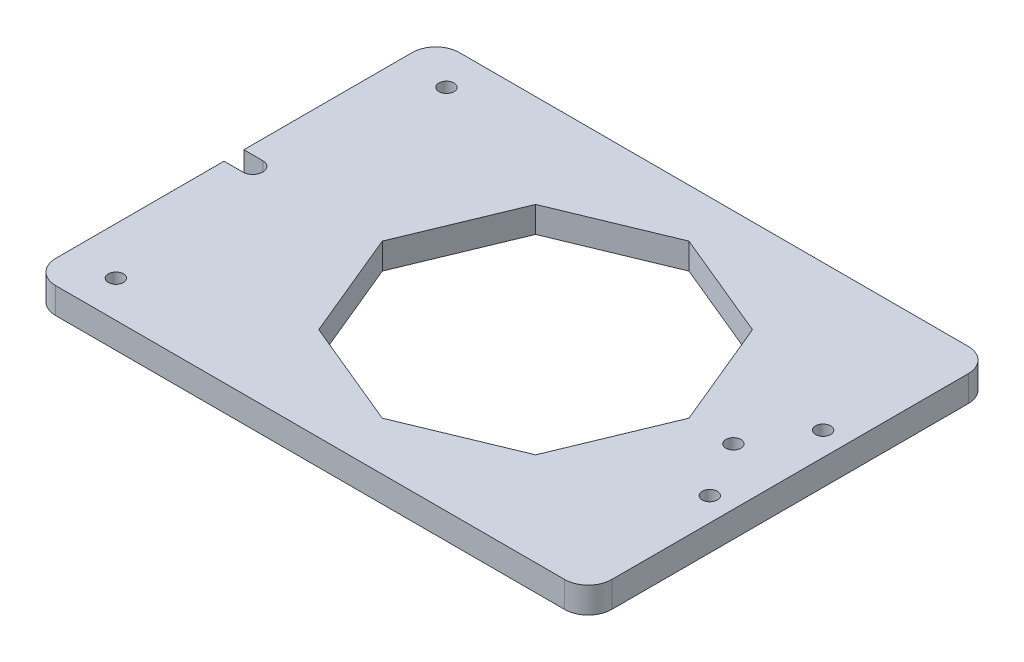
SolidWorks part; units mm, degrees
ref_plane "Front Plane" through (0, 0, 0) normal (0, 0, 1) x (1, 0, 0)
ref_plane "Top Plane" through (0, 0, 0) normal (0, 1, 0) x (1, 0, 0)
ref_plane "Right Plane" through (0, 0, 0) normal (1, 0, 0) x (0, 0, -1)
sketch "Sketch1" plane through (0, 0, 0) normal (0, 1, 0) x (1, 0, 0)
  line L9 (0, 42.74) -> (53.88, 42.74)
  line L15 (53.88, -42.74) -> (-63.88, -42.74)
  line L16 (-63.88, -42.74) -> (-63.88, -2.1)
  line L17 (-63.88, 42.74) -> (0, 42.74)
  line L19 (53.88, 42.74) -> (53.88, -42.74)
  line L31 (0, -32.4718) -> (22.961, -22.961)
  line L38 (-59.88, 2.1) -> (-63.88, 2.1)
  line L39 (-63.88, 2.1) -> (-63.88, 42.74)
  line L40 (-59.88, -2.1) -> (-63.88, -2.1)
  line L41 (27.7164, 11.4805) -> (25.4328, 16.9936)
  line L42 (25.4328, 16.9936) -> (22.961, 22.961)
  line L43 (27.7164, -11.4805) -> (22.961, -22.961)
  line L44 (27.7164, -11.4805) -> (32.4718, 0)
  line L47 (-11.4805, -27.7164) -> (0, -32.4718)
  line L48 (27.7164, 11.4805) -> (32.4718, 0)
  line L49 (-27.7164, -11.4805) -> (-22.961, -22.961)
  line L51 (-27.7164, 11.4805) -> (-32.4718, 0)
  line L53 (-11.4805, 27.7164) -> (-22.961, 22.961)
  line L55 (11.4805, 27.7164) -> (0, 32.4718)
  line L56 (11.4805, 27.7164) -> (22.961, 22.961)
  line L57 (-11.4805, 27.7164) -> (0, 32.4718)
  line L58 (-27.7164, 11.4805) -> (-22.961, 22.961)
  line L59 (-27.7164, -11.4805) -> (-32.4718, 0)
  line L60 (-11.4805, -27.7164) -> (-22.961, -22.961)
  line L68 (11.4805, -27.7164) -> (16.9936, -25.4328)
  line L70 (27.7164, -11.4805) -> (30, -5.9674)
  circle A3 centre (48.88, 12) radius 1.6
  circle A4 centre (48.88, -12) radius 1.6
  circle A6 centre (41.88, 0) radius 1.6
  circle A14 centre (-53.88, 35) radius 1.6
  circle A15 centre (-53.88, -35) radius 1.6
  arc A16 (-59.88, -2.1) -> (-59.88, 2.1) centre (-59.88, 0) ccw
  point P31 (0, 0)
  point P56 (0, 0)
  dimension "D1" = 8
extrude "Boss-Extrude1" add sketch "Sketch1" along normal blind 5.5
fillet "Fillet1" radius 5 4 edges at (-63.88, 2.75, -42.74) (53.88, 2.75, -42.74) (-63.88, 2.75, 42.74) (53.88, 2.75, 42.74)
